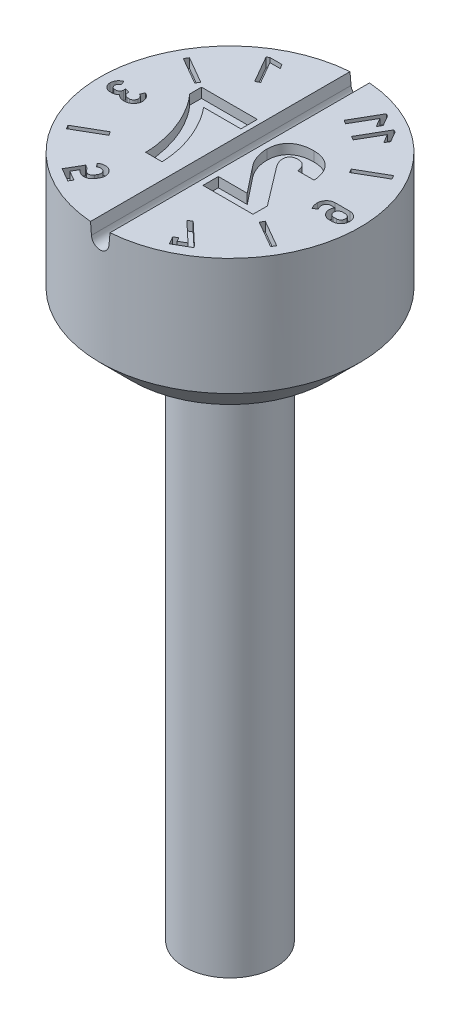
SolidWorks part; units mm, degrees
ref_plane "Front Plane" through (0, 0, 0) normal (0, 0, 1) x (1, 0, 0)
ref_plane "Top Plane" through (0, 0, 0) normal (0, 1, 0) x (1, 0, 0)
ref_plane "Right Plane" through (0, 0, 0) normal (1, 0, 0) x (0, 0, -1)
imported_body "Imported1"
sketch "Sketch1" plane through (0, -0.15, 0) normal (0, 1, 0) x (1, 0, 0)
  line L2 (-0.271, -0.2942) -> (-0.271, 0.2969)
  line L3 (-1.0488, 0.2969) -> (-1.0488, -0.2942)
  line L4 (-0.271, -0.2942) -> (-0.271, 0.2969)
  line L5 (-1.0488, 0.2969) -> (-1.0488, -0.2942)
  spline S4 degree 3 poles (2994.4705, 176.8411) (-18.9836, -5.3744) (0.0034, -1.9139) (-0.2768, 0.3791) (-0.2843, 0.4171) (-0.2952, 0.4525) (-0.3092, 0.4856) (-0.3265, 0.5161) (-0.3468, 0.5442) (-0.3702, 0.5697) (-0.3965, 0.5927) (-0.4259, 0.6123) (-0.4582, 0.629) (-0.4931, 0.6429) (-0.5308, 0.6534) (-0.5714, 0.6607) (-3.1291, 0.9309) (-6.6572, -17.4741) (149.6947, 2996.7881) knots -11.12639 -11.12639 -11.12639 -11.12639 0.06986 0.136229 0.199072 0.25942 0.317893 0.375172 0.431376 0.487845 0.544707 0.602193 0.661345 0.722459 0.786428 0.853446 0.924507 13.399563 13.399563 13.399563 13.399563 only from (-0.271, 0.2969) to (-0.6599, 0.6662)
  spline S5 degree 3 poles (-151.0627, 2996.8497) (5.3528, -17.4107) (1.8179, 0.9306) (-0.7487, 0.6607) (-0.7894, 0.6534) (-0.8273, 0.6429) (-0.8621, 0.629) (-0.8943, 0.6126) (-0.9236, 0.5929) (-0.9499, 0.57) (-0.9733, 0.5445) (-0.9935, 0.5164) (-1.011, 0.4861) (-1.0246, 0.4529) (-1.0354, 0.4174) (-1.0435, 0.3795) (-1.3071, -2.0641) (16.6253, -5.3462) (-2997.9649, 133.1801) knots -12.434531 -12.434531 -12.434531 -12.434531 0.075447 0.146896 0.214298 0.278228 0.339305 0.397836 0.455287 0.512114 0.568549 0.624718 0.681585 0.739853 0.800578 0.863471 0.92975 12.839416 12.839416 12.839416 12.839416 only from (-0.6599, 0.6662) to (-1.0488, 0.2969)
  spline S6 degree 3 poles (-2995.6461, -179.6533) (17.7835, 5.3733) (-1.3244, 1.9021) (-1.043, -0.3763) (-1.0355, -0.4141) (-1.0246, -0.4496) (-1.0106, -0.4826) (-0.9933, -0.5133) (-0.9728, -0.5415) (-0.9493, -0.5671) (-0.9231, -0.59) (-0.8936, -0.6097) (-0.8615, -0.6264) (-0.8264, -0.6398) (-0.7889, -0.6509) (-0.7483, -0.658) (1.7818, -0.9301) (5.3903, 17.56) (-167.4806, -2995.8871) knots -11.059669 -11.059669 -11.059669 -11.059669 0.06988 0.135837 0.198699 0.259064 0.317554 0.374849 0.431675 0.488161 0.545039 0.602541 0.661711 0.722684 0.786373 0.853837 0.924919 13.273114 13.273114 13.273114 13.273114 only from (-1.0488, -0.2942) to (-0.6599, -0.6635)
  spline S7 degree 3 poles (141.2292, -2997.2372) (-6.6628, 17.2306) (-3.1641, -0.9253) (-0.5711, -0.6581) (-0.5304, -0.6505) (-0.4926, -0.6397) (-0.4576, -0.6258) (-0.4253, -0.6092) (-0.3959, -0.5892) (-0.3697, -0.566) (-0.3463, -0.5403) (-0.3261, -0.512) (-0.3089, -0.4815) (-0.2953, -0.4485) (-0.2843, -0.4132) (-0.2764, -0.3757) (-0.0114, 2.0143) (-17.9999, 5.3233) (2996.0538, -146.2482) knots -12.575974 -12.575974 -12.575974 -12.575974 0.075539 0.147075 0.214639 0.278766 0.339917 0.399105 0.456869 0.514052 0.570876 0.627466 0.684188 0.742528 0.802498 0.865468 0.930965 12.596589 12.596589 12.596589 12.596589 only from (-0.6599, -0.6635) to (-0.271, -0.2942)
  spline S8 degree 3 poles (-0.271, 0.2969) (-0.2713, 0.3111) (-0.2718, 0.3388) (-0.2768, 0.3791) (-0.2843, 0.4171) (-0.2952, 0.4525) (-0.3092, 0.4856) (-0.3265, 0.5161) (-0.3468, 0.5442) (-0.3702, 0.5697) (-0.3965, 0.5927) (-0.4259, 0.6123) (-0.4582, 0.629) (-0.4931, 0.6429) (-0.5308, 0.6534) (-0.5714, 0.6607) (-0.6147, 0.6653) (-0.6445, 0.6659) (-0.6599, 0.6662) knots 0 0 0 0 0.06986 0.136229 0.199072 0.25942 0.317893 0.375172 0.431376 0.487845 0.544707 0.602193 0.661345 0.722459 0.786428 0.853446 0.924507 1 1 1 1
  spline S9 degree 3 poles (-0.6599, 0.6662) (-0.6753, 0.6659) (-0.7052, 0.6653) (-0.7487, 0.6607) (-0.7894, 0.6534) (-0.8273, 0.6429) (-0.8621, 0.629) (-0.8943, 0.6126) (-0.9236, 0.5929) (-0.9499, 0.57) (-0.9733, 0.5445) (-0.9935, 0.5164) (-1.011, 0.4861) (-1.0246, 0.4529) (-1.0354, 0.4174) (-1.0435, 0.3795) (-1.0479, 0.339) (-1.0485, 0.3112) (-1.0488, 0.2969) knots 0 0 0 0 0.075447 0.146896 0.214298 0.278228 0.339305 0.397836 0.455287 0.512114 0.568549 0.624718 0.681585 0.739853 0.800578 0.863471 0.92975 1 1 1 1
  spline S10 degree 3 poles (-1.0488, -0.2942) (-1.0486, -0.3084) (-1.048, -0.3361) (-1.043, -0.3763) (-1.0355, -0.4141) (-1.0246, -0.4496) (-1.0106, -0.4826) (-0.9933, -0.5133) (-0.9728, -0.5415) (-0.9493, -0.5671) (-0.9231, -0.59) (-0.8936, -0.6097) (-0.8615, -0.6264) (-0.8264, -0.6398) (-0.7889, -0.6509) (-0.7483, -0.658) (-0.705, -0.6626) (-0.6752, -0.6632) (-0.6599, -0.6635) knots 0 0 0 0 0.06988 0.135837 0.198699 0.259064 0.317554 0.374849 0.431675 0.488161 0.545039 0.602541 0.661711 0.722684 0.786373 0.853837 0.924919 1 1 1 1
  spline S11 degree 3 poles (-0.6599, -0.6635) (-0.6445, -0.6632) (-0.6146, -0.6626) (-0.5711, -0.6581) (-0.5304, -0.6505) (-0.4926, -0.6397) (-0.4576, -0.6258) (-0.4253, -0.6092) (-0.3959, -0.5892) (-0.3697, -0.566) (-0.3463, -0.5403) (-0.3261, -0.512) (-0.3089, -0.4815) (-0.2953, -0.4485) (-0.2843, -0.4132) (-0.2764, -0.3757) (-0.2719, -0.3356) (-0.2713, -0.3083) (-0.271, -0.2942) knots 0 0 0 0 0.075539 0.147075 0.214639 0.278766 0.339917 0.399105 0.456869 0.514052 0.570876 0.627466 0.684188 0.742528 0.802498 0.865468 0.930965 1 1 1 1
  dimension "D1" = 0
extrude "Boss-Extrude1" add sketch "Sketch1" along normal up to surface (0.15 mm away)
sketch "Sketch2" plane through (0, 0, 0) normal (0, 1, 0) x (1, 0, 0)
  line L0 (0.2345, -0.65) -> (1.0033, -0.65) construction
  text T0 "7" font "Arial" height 1.3132
extrude "Cut-Extrude1" cut sketch "Sketch2" against normal up to surface (0.15 mm away)
